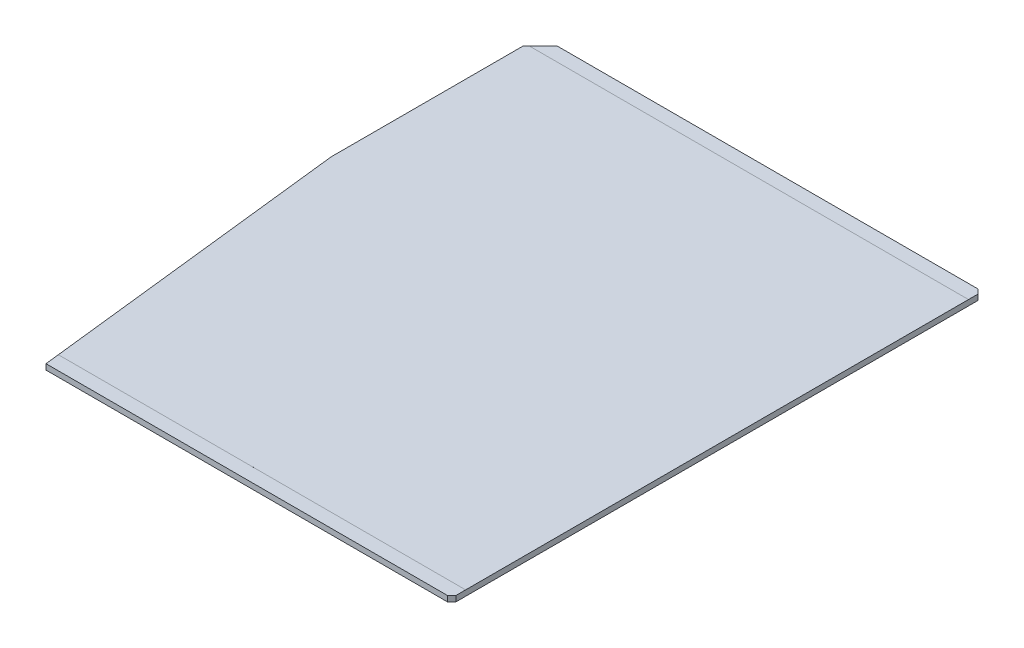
SolidWorks part; units mm, degrees
ref_plane "Front Plane" through (0, 0, 0) normal (0, 0, 1) x (1, 0, 0)
ref_plane "Top Plane" through (0, 0, 0) normal (0, 1, 0) x (1, 0, 0)
ref_plane "Right Plane" through (0, 0, 0) normal (1, 0, 0) x (0, 0, -1)
sketch "Sketch1" plane through (0, 0, 0) normal (0, 1, 0) x (1, 0, 0)
  line L1 (-63.5, 76.2) -> (63.5, 76.2)
  line L2 (-63.5, 76.2) -> (-63.5, -76.2)
  line L3 (-63.5, -76.2) -> (63.5, -76.2)
  line L4 (63.5, 76.2) -> (63.5, -76.2)
  line L5 (-63.5, 76.2) -> (63.5, -76.2) construction
  line L6 (-63.5, -76.2) -> (63.5, 76.2) construction
  point P0 (0, 0)
  dimension "D1" = 127
  dimension "D2" = 152.4
extrude "Boss-Extrude1" add sketch "Sketch1" along normal blind 1.6
chamfer "Chamfer1" distance 5 angle 45 2 edges at (-63.5, 0.8, -76.2) (-63.5, 0.8, 76.2)
chamfer "Chamfer2" distance 1.27 angle 45 2 edges at (63.5, 0.8, 76.2) (63.5, 0.8, -76.2)
sketch "Sketch4" plane through (0, 1.6, 0) normal (0, 1, 0) x (-1, 0, 0)
  line L0 (-72.4805, 72.2) -> (74.1649, 72.2)
  line L3 (58.5, 76.2) -> (-62.23, 76.2) construction
  line L5 (-72.4805, -72.2) -> (74.1649, -72.2)
  line L7 (-62.23, -76.2) -> (58.5, -76.2) construction
  line L9 (-72.4805, 72.2) -> (-72.4805, -72.2)
  line L10 (74.1649, 72.2) -> (74.1649, -72.2)
  dimension "D1" = 4
  dimension "D2" = 4
extrude "Cut-Extrude3" cut sketch "Sketch4" against normal blind 0.0001 flip side to cut
sketch "Sketch5" plane through (0, 1.6, 0) normal (0, 1, 0) x (1, 0, 0)
  line L2 (-53, -76.2) -> (-63.5, 16.2)
  line L3 (-58.5, -76.2) -> (62.23, -76.2) construction
  line L4 (-63.5, 71.2) -> (-63.5, -71.2) construction
  line L5 (62.23, 76.2) -> (-58.5, 76.2) construction
  dimension "D1" = 10.5
  dimension "D2" = 60
extrude "Cut-Extrude4" cut sketch "Sketch5" against normal through all and the other way through all
